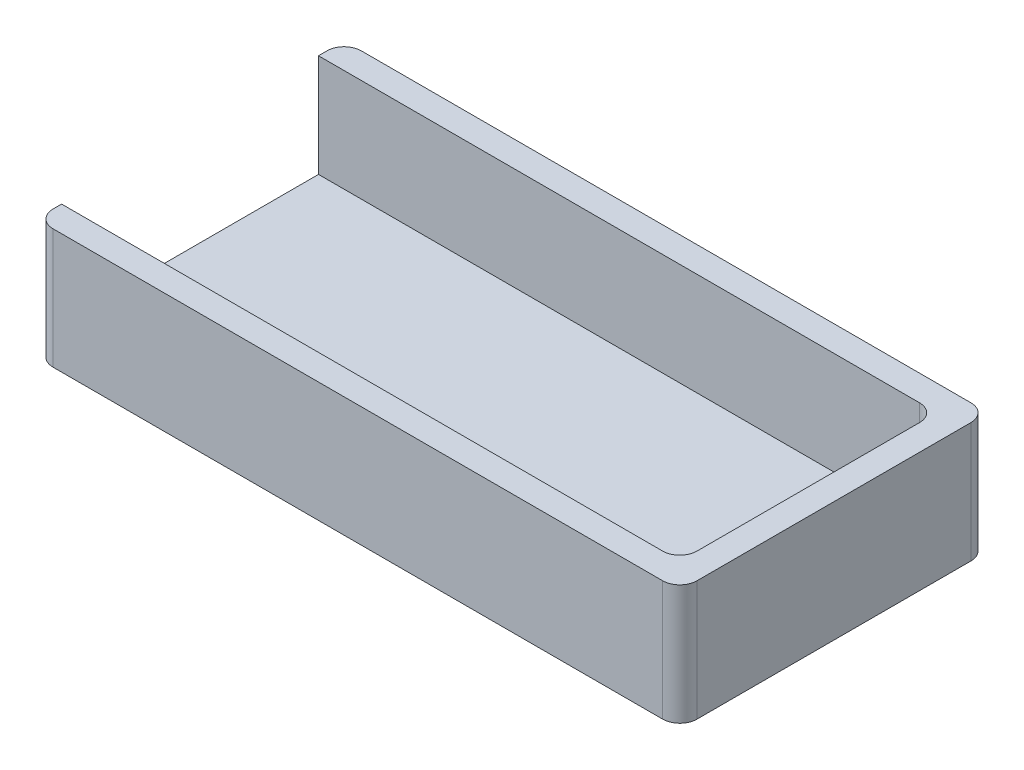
SolidWorks part; units mm, degrees
ref_plane "Alzado" through (0, 0, 0) normal (0, 0, 1) x (1, 0, 0)
ref_plane "Planta" through (0, 0, 0) normal (0, 1, 0) x (1, 0, 0)
ref_plane "Vista lateral" through (0, 0, 0) normal (1, 0, 0) x (0, 0, -1)
sketch "Croquis1" plane through (0, 0, 0) normal (0, 1, 0) x (1, 0, 0)
  line L1 (0, 0) -> (37.6, 0)
  line L2 (0, 0) -> (0, 18)
  line L3 (0, 18) -> (37.6, 18)
  line L4 (37.6, 0) -> (37.6, 18)
  dimension "D1" = 37.6
  dimension "D2" = 18
extrude "Saliente-Extruir1" add sketch "Croquis1" along normal blind 1
sketch "Croquis2" plane through (0, 1, 0) normal (0, 1, 0) x (1, 0, 0)
  line L0 (0, 18) -> (37.6, 18)
  line L1 (37.6, 18) -> (37.6, 0)
  line L2 (37.6, 0) -> (0, 0)
  line L3 (0, 0) -> (0, 1.5)
  line L4 (0, 18) -> (0, 0) construction
  line L5 (0, 1.5) -> (36.1, 1.5)
  line L6 (36.1, 1.5) -> (36.1, 16.5)
  line L7 (36.1, 16.5) -> (0, 16.5)
  line L8 (0, 16.5) -> (0, 18)
  dimension "D1" = 1.5
  dimension "D2" = 1.5
  dimension "D3" = 1.5
extrude "Saliente-Extruir2" add sketch "Croquis2" along normal blind 6
fillet "Redondeo8" radius 1 6 edges at (36.1, 4, -16.5) (36.1, 4, -1.5) (37.6, 3.5, -18) (37.6, 3.5, 0) (0, 3.5, 0) (0, 3.5, -18)
